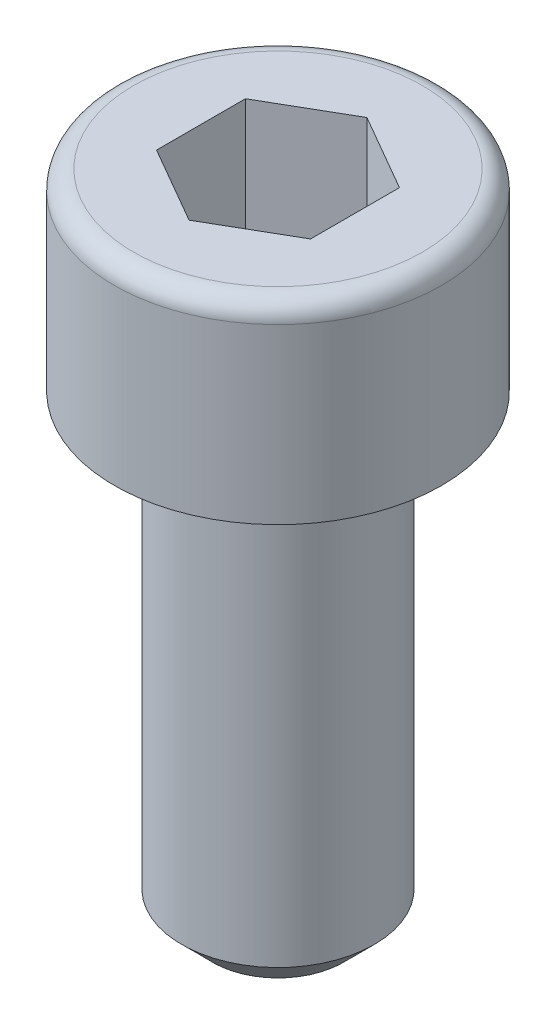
SolidWorks part; units mm, degrees
ref_plane "Face" through (0, 0, 0) normal (0, 0, 1) x (1, 0, 0)
ref_plane "Dessus" through (0, 0, 0) normal (0, 1, 0) x (1, 0, 0)
ref_plane "Droite" through (0, 0, 0) normal (1, 0, 0) x (0, 0, -1)
sketch "E_corps" plane through (0, 0, 0) normal (0, 0, 1) x (1, 0, 0)
  line L0 (0, 65.1173) -> (0, -17) construction
  line L1 (2.5, -5) -> (4.25, -5)
  line L2 (4.25, -5) -> (4.25, -0.5)
  line L3 (2.5, -5) -> (2.5, -16.2)
  line L4 (1.7, -17) -> (0, -17)
  line L5 (0, -17) -> (0, 0)
  line L6 (1.7, -17) -> (2.5, -16.2)
  line L8 (3.75, 0) -> (0, 0)
  line L9 (50, 0) -> (-50, 0) construction
  arc A0 (4.25, -0.5) -> (3.75, 0) centre (3.75, -0.5) ccw
  dimension "Rayon_tête_de_vis" = 0.5
  dimension "Diamètre_nominal" = 5
  dimension "Diamètre_de_tête" = 8.5
  dimension "D1" = 45
  dimension "Longueur_sous_tête" = 12
  dimension "Chanfrein" = 0.8
  dimension "Hauteur_de_tête" = 5
revolve "corps" add sketch "E_corps" angle 360 about L0
sketch "E_empreinte" plane through (0, 0, 0) normal (0, 1, 0) x (-1, 0, 0)
  line L0 (0, -2.1738) -> (0, 1.8712) construction
  line L1 (0, -2.3094) -> (-2, -1.1547)
  line L2 (0, -2.3094) -> (2, -1.1547)
  line L3 (-2, -1.1547) -> (-2, 1.1547)
  line L4 (2, -1.1547) -> (2, 1.1547)
  line L5 (-2, 1.1547) -> (0, 2.3094)
  line L6 (2, 1.1547) -> (0, 2.3094)
  circle A0 centre (0, 0) radius 2.3094 construction
  dimension "a" = 4
extrude "Empreinte" cut sketch "E_empreinte" against normal blind 3.6
ref_plane "Empreinte_6_pans_creux" through (0, -4, 0) normal (0, 1, 0) x (-1, 0, 0)
sketch "Esquisse1" plane through (0, -4, 0) normal (0, 1, 0) x (-1, 0, 0)
  point P0 (0, 0)
sketch "Esquisse2" plane through (0, -3.6, 0) normal (0, 1, 0) x (-1, 0, 0)
  line L6 (0, -2.3094) -> (2, -1.1547)
  line L7 (2, -1.1547) -> (2, 1.1547)
  line L8 (2, 1.1547) -> (0, 2.3094)
  line L9 (0, 2.3094) -> (-2, 1.1547)
  line L10 (-2, 1.1547) -> (-2, -1.1547)
  line L11 (-2, -1.1547) -> (0, -2.3094)
  line L12 (0, -2.3094) -> (2, -1.1547)
  line L13 (2, -1.1547) -> (2, 1.1547)
  line L14 (2, 1.1547) -> (0, 2.3094)
  line L15 (0, 2.3094) -> (-2, 1.1547)
  line L16 (-2, 1.1547) -> (-2, -1.1547)
  line L17 (-2, -1.1547) -> (0, -2.3094)
  dimension "D1" = 0
loft "Enlever de la matière-lisser1" cut profiles "Esquisse1", "Esquisse2"
sketch "E_ligne_de_fraction" plane through (0, 0, 0) normal (0, 0, 1) x (1, 0, 0)
  line L0 (-3.5, -17) -> (3.5, -17)
  line L1 (2.5, -5) -> (2.5, -16.2) construction
  line L2 (0, 20.6911) -> (0, -58.664) construction
  line L3 (0, 65.1173) -> (0, -17) construction
  line L5 (-1.7, -17) -> (1.7, -17) construction
  dimension "D1" = 1
  dimension "Longueur_fileté" = 0
equation "\"Rayon_tête_de_vis@E_corps\" = 0.1*\"Diamètre_nominal@E_corps\""
equation "\"Hauteur_de_tête@E_corps\" = \"Diamètre_nominal@E_corps\""
equation "\"Profondeur@Empreinte_6_pans_creux\" = 0.8*\"Hauteur_de_tête@E_corps\""
equation "\"D2@Empreinte\"=0.9*\"Profondeur@Empreinte_6_pans_creux\""
